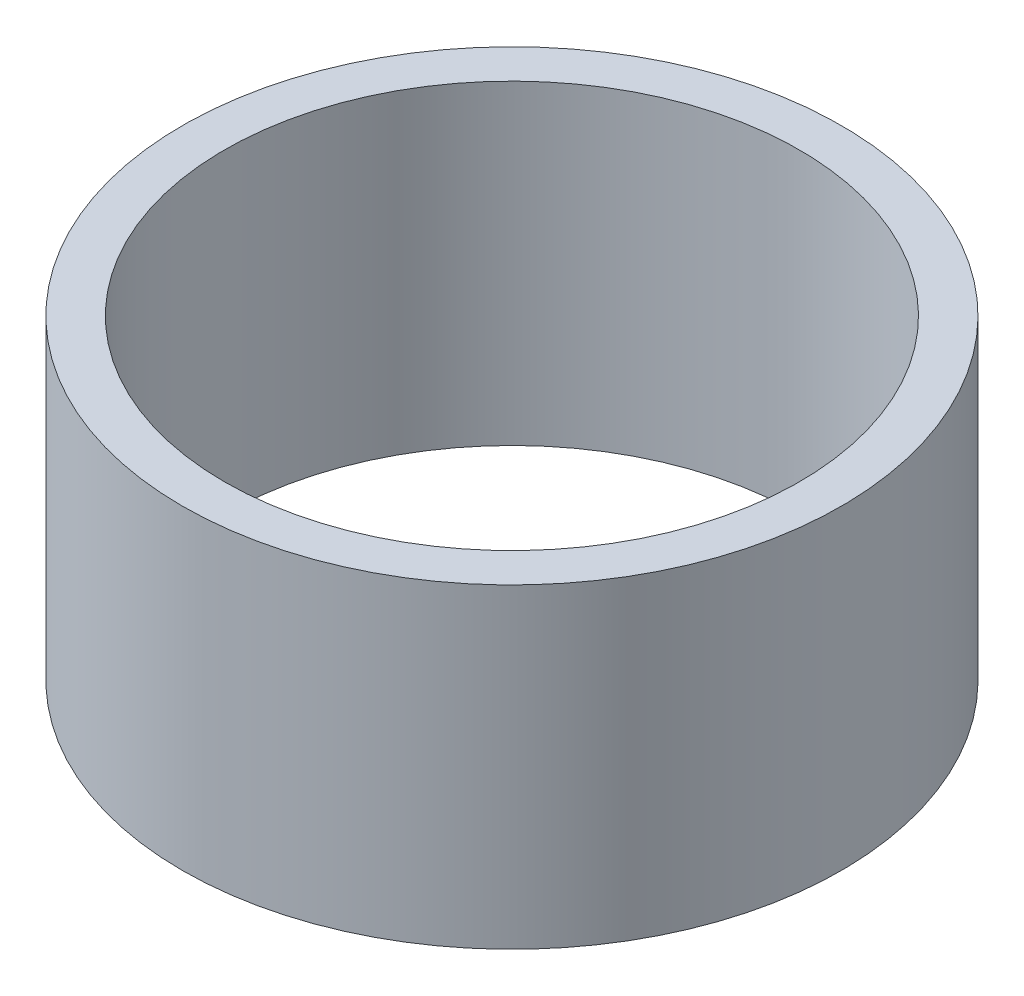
SolidWorks part; units mm, degrees
ref_plane "Face" through (0, 0, 0) normal (0, 0, 1) x (1, 0, 0)
ref_plane "Dessus" through (0, 0, 0) normal (0, 1, 0) x (1, 0, 0)
ref_plane "Droite" through (0, 0, 0) normal (1, 0, 0) x (0, 0, -1)
sketch "Esquisse1" plane through (0, 0, 0) normal (0, 0, 1) x (1, 0, 0)
  line L1 (20.5, 25.8943) -> (23.5, 25.8943)
  line L2 (20.5, 25.8943) -> (20.5, 3.3943)
  line L3 (20.5, 3.3943) -> (23.5, 3.3943)
  line L4 (23.5, 25.8943) -> (23.5, 3.3943)
  line L7 (0, 28.1201) -> (0, -6.7506) construction
  line L8 (0, 350) -> (0, -250) construction
  dimension "D1" = 23.5
  dimension "D2" = 3
  dimension "D3" = 22.5
revolve "Révolution1" add sketch "Esquisse1" angle 360 about L7
